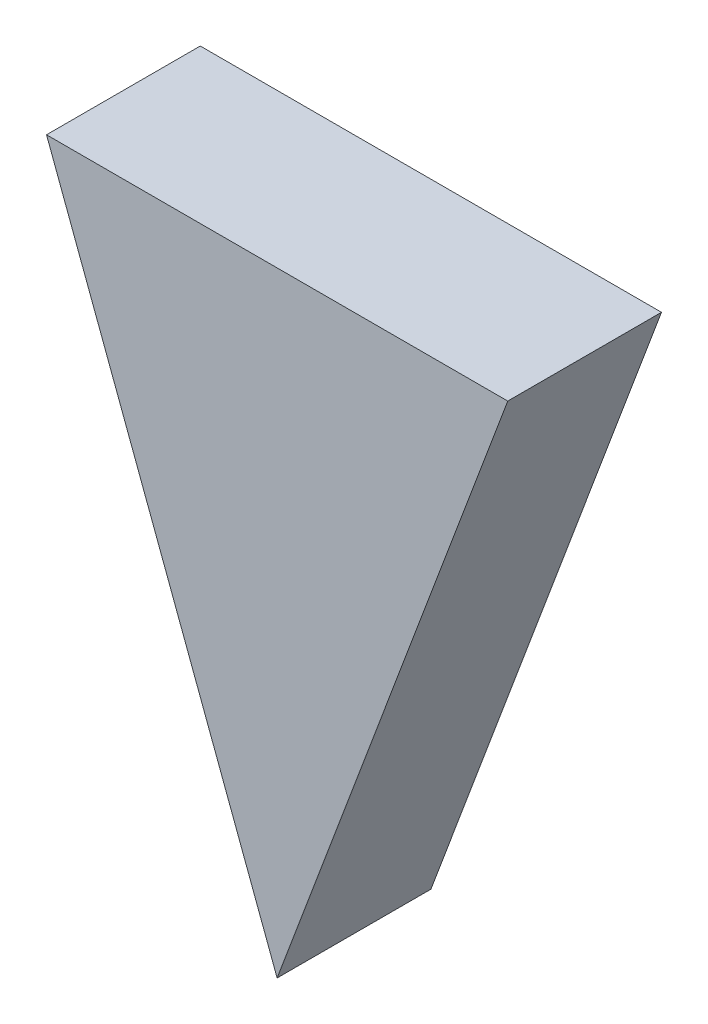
SolidWorks part; units mm, degrees
ref_plane "Ebene vorne" through (0, 0, 0) normal (0, 0, 1) x (1, 0, 0)
ref_plane "Ebene oben" through (0, 0, 0) normal (0, 1, 0) x (1, 0, 0)
ref_plane "Ebene rechts" through (0, 0, 0) normal (1, 0, 0) x (0, 0, -1)
sketch "Skizze1" plane through (0, 0, 0) normal (0, 0, 1) x (1, 0, 0)
  line L0 (0, 0) -> (-15, 40)
  line L1 (-15, 40) -> (15, 40)
  line L2 (15, 40) -> (0, 0)
  line L3 (0, 0) -> (0, 72.8035) construction
  dimension "D1" = 30
  dimension "D2" = 40
extrude "Aufsatz-Linear austragen1" add sketch "Skizze1" along normal blind 10
